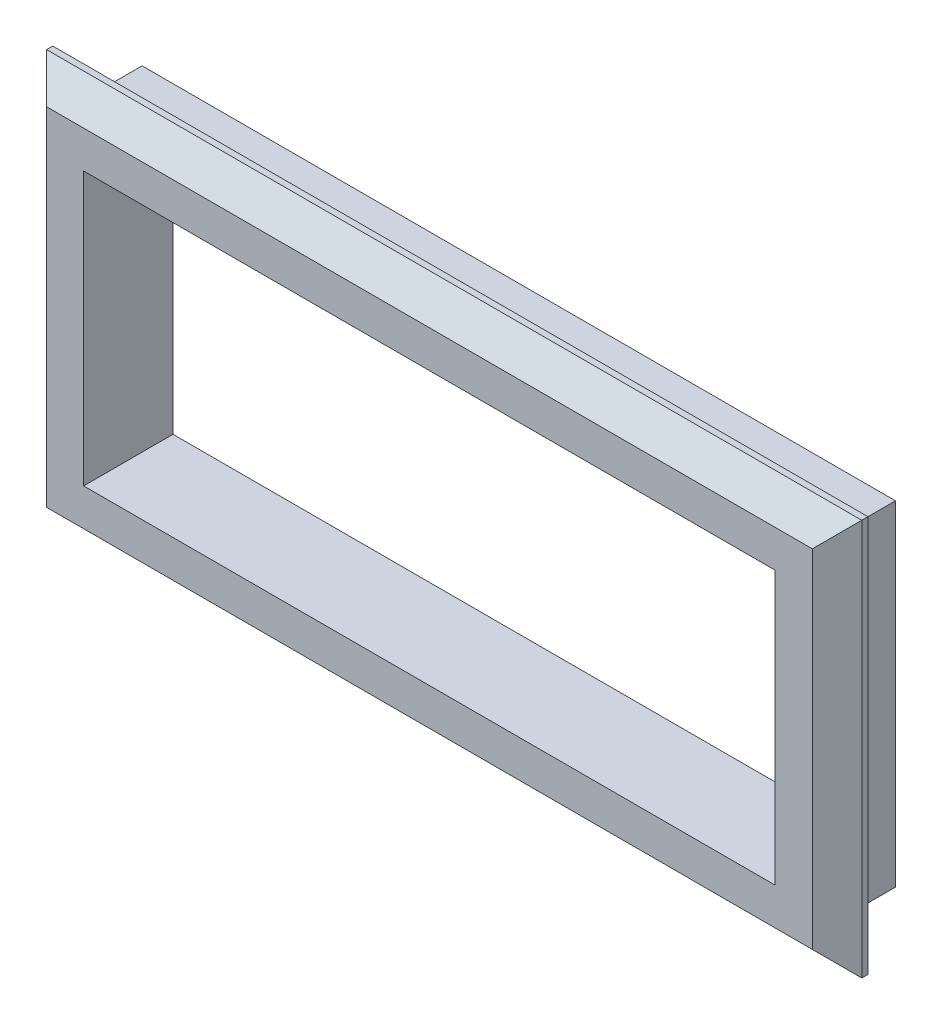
SolidWorks part; units mm, degrees
ref_plane "Front Plane" through (0, 0, 0) normal (0, 0, 1) x (1, 0, 0)
ref_plane "Top Plane" through (0, 0, 0) normal (0, 1, 0) x (1, 0, 0)
ref_plane "Right Plane" through (0, 0, 0) normal (1, 0, 0) x (0, 0, -1)
sketch "Sketch1" plane through (0, 0, 0) normal (0, 0, 1) x (1, 0, 0)
  line L5 (0, 0) -> (71, 0)
  line L6 (0, 0) -> (0, 28)
  line L7 (0, 28) -> (71, 28)
  line L8 (71, 0) -> (71, 28)
  line L9 (-3.175, -3.175) -> (74.175, -3.175)
  line L10 (-3.175, -3.175) -> (-3.175, 31.175)
  line L11 (-3.175, 31.175) -> (74.175, 31.175)
  line L12 (74.175, -3.175) -> (74.175, 31.175)
  dimension "D1" = 71
  dimension "D2" = 28
  dimension "D3" = 3.175
  dimension "D4" = 3.175
  dimension "D5" = 3.175
  dimension "D6" = 3.175
extrude "Boss-Extrude1" add sketch "Sketch1" along normal blind 6
sketch "Sketch2" plane through (0, 0, 6) normal (0, 0, 1) x (1, 0, 0)
  line L1 (0, 28) -> (71, 28)
  line L2 (0, 28) -> (0, 0)
  line L3 (0, 0) -> (71, 0)
  line L4 (71, 28) -> (71, 0)
  line L5 (-6.35, 34.35) -> (77.35, 34.35)
  line L6 (-6.35, 34.35) -> (-6.35, -6.35)
  line L7 (-6.35, -6.35) -> (77.35, -6.35)
  line L8 (77.35, 34.35) -> (77.35, -6.35)
  dimension "D1" = 6.35
  dimension "D2" = 6.35
  dimension "D3" = 6.35
  dimension "D4" = 6.35
extrude "Boss-Extrude2" add sketch "Sketch2" along normal blind 3.175
chamfer "Chamfer1" distance 2.54 angle 45 4 edges at (77.35, 14, 9.175) (35.5, -6.35, 9.175) (-6.35, 14, 9.175) (35.5, 34.35, 9.175)
